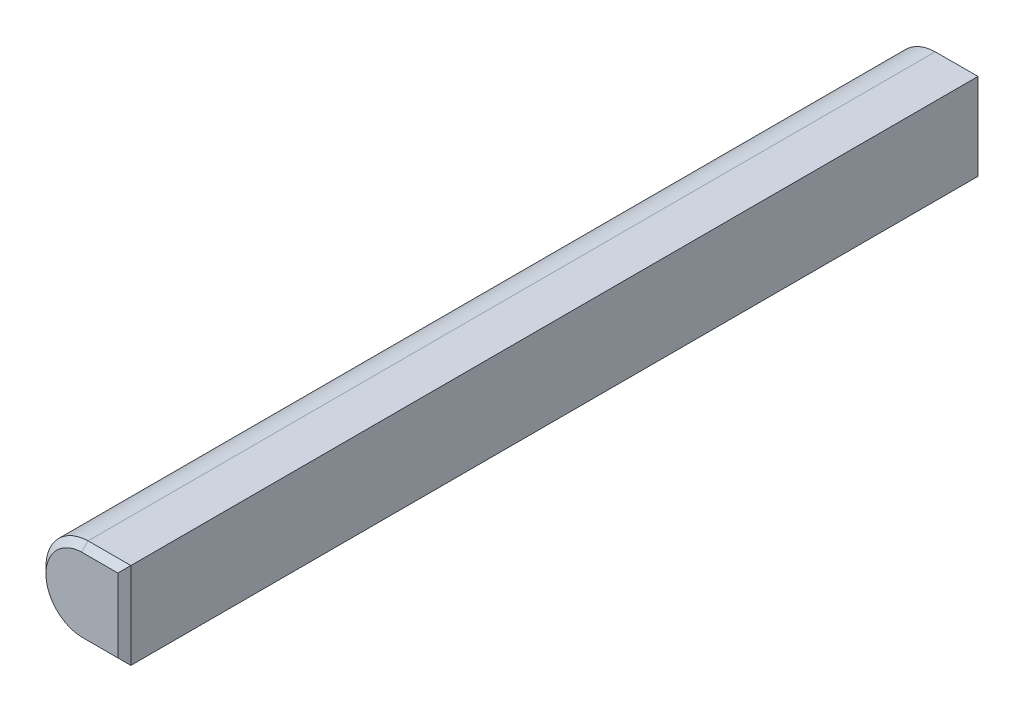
SolidWorks part; units mm, degrees
ref_plane "Front Plane" through (0, 0, 0) normal (0, 0, 1) x (1, 0, 0)
ref_plane "Top Plane" through (0, 0, 0) normal (0, 1, 0) x (1, 0, 0)
ref_plane "Right Plane" through (0, 0, 0) normal (1, 0, 0) x (0, 0, -1)
sketch "Sketch1" plane through (0, 0, 0) normal (0, 0, 1) x (1, 0, 0)
  line L1 (-0.1, 3.9487) -> (3.8, 3.9487) construction
  line L2 (3.8, 3.9487) -> (3.8, -3.9487) construction
  line L3 (3.8, -3.9487) -> (-0.1, -3.9487) construction
  line L4 (3.85, -3.9987) -> (-0.1006, -3.9987)
  line L5 (-0.1006, 3.9987) -> (3.85, 3.9987)
  line L6 (3.85, 3.9987) -> (3.85, -3.9987)
  arc A0 (-0.1, 3.9487) -> (-0.1, -3.9487) centre (0, 0) ccw construction
  arc A1 (-0.1006, 3.9987) -> (-0.1006, -3.9987) centre (0, 0) ccw
  dimension "D1" = 7.9
  dimension "D2" = 0.05
  dimension "D3" = 3.9
  dimension "D4" = 3.9
extrude "Boss-Extrude1" add sketch "Sketch1" along normal blind 79.5
chamfer "Chamfer1" distance 0.6 angle 45 8 edges at (1.8747, 3.9987, 0) (-4, 0, 0) (1.8747, -3.9987, 0) (3.85, 0, 0) (1.8747, -3.9987, 79.5) (-4, 0, 79.5) (1.8747, 3.9987, 79.5) (3.85, 0, 79.5)
